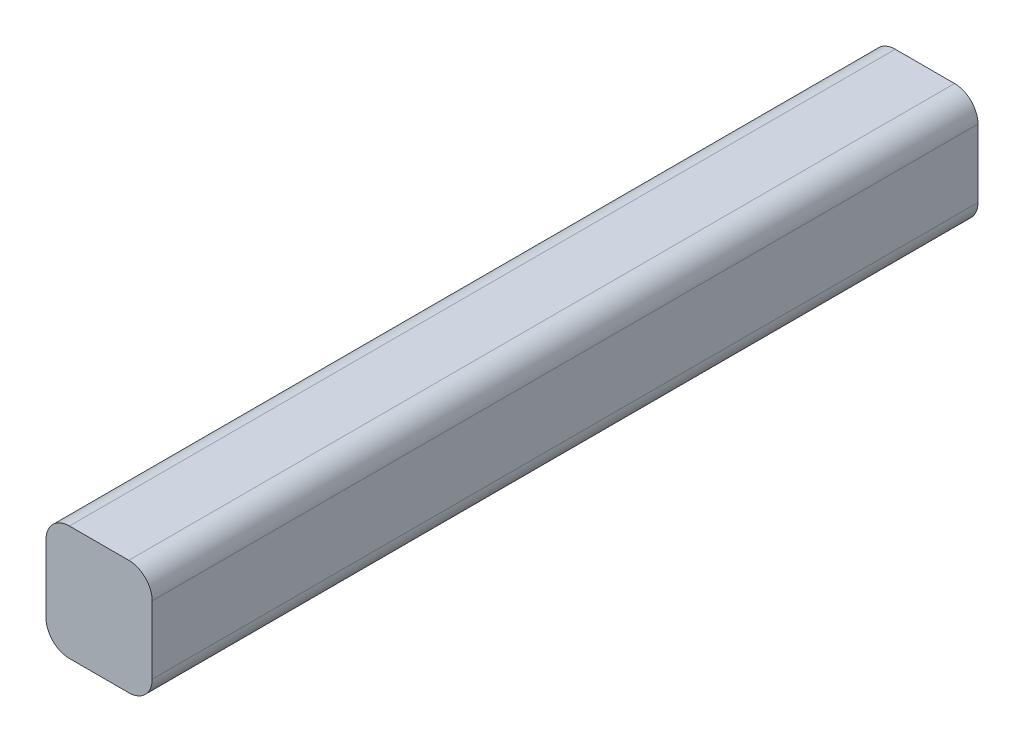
SolidWorks part; units mm, degrees
ref_plane "Front Plane" through (0, 0, 0) normal (0, 0, 1) x (1, 0, 0)
ref_plane "Top Plane" through (0, 0, 0) normal (0, 1, 0) x (1, 0, 0)
ref_plane "Right Plane" through (0, 0, 0) normal (1, 0, 0) x (0, 0, -1)
sketch "Sketch1" plane through (0, 0, 0) normal (0, 0, 1) x (1, 0, 0)
  line L1 (22.78, 22.78) -> (22.78, -22.79)
  line L2 (22.78, -22.79) -> (-19.39, -22.79)
  line L3 (-19.39, -22.79) -> (-19.39, 22.78)
  line L5 (-19.39, 22.78) -> (22.78, 22.78)
  dimension "D1" = 45.57
  dimension "D2" = 42.17
extrude "Boss-Extrude1" add sketch "Sketch1" along normal blind 328
fillet "Fillet1" radius 9.3 4 edges at (-19.39, -22.79, 164) (-19.39, 22.78, 164) (22.78, 22.78, 164) (22.78, -22.79, 164)
